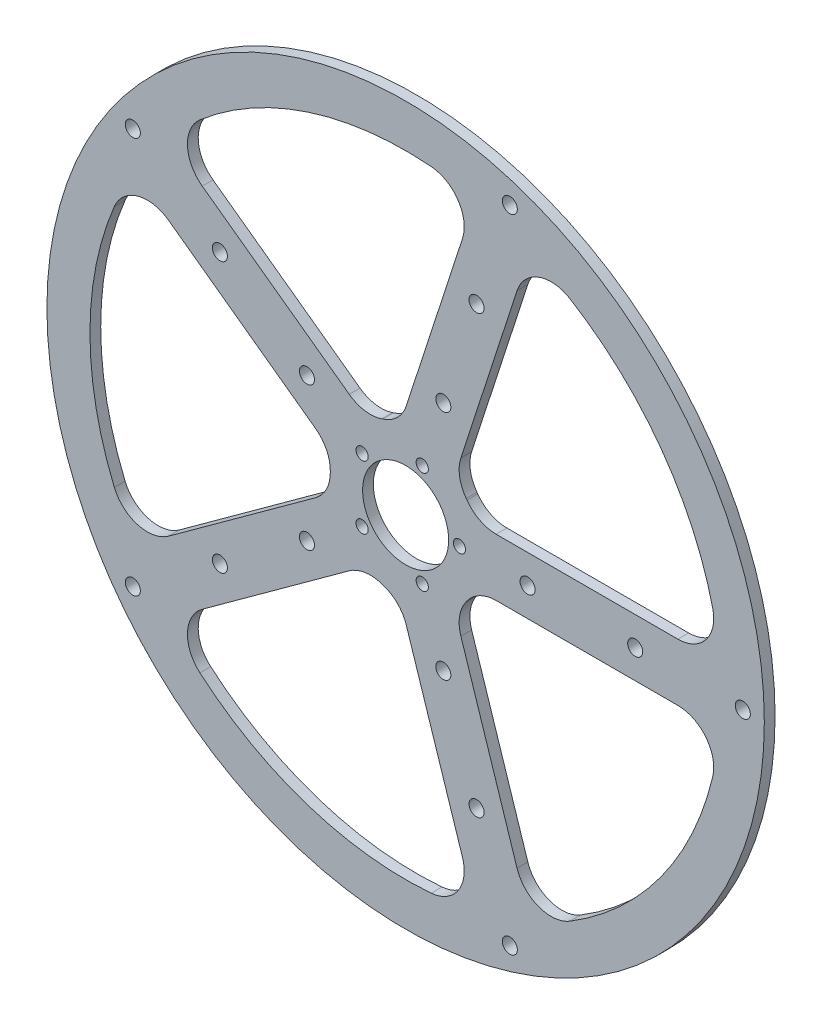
SolidWorks part; units mm, degrees
ref_plane "Plan de face" through (0, 0, 0) normal (0, 0, 1) x (1, 0, 0)
ref_plane "Plan de dessus" through (0, 0, 0) normal (0, 1, 0) x (1, 0, 0)
ref_plane "Plan de droite" through (0, 0, 0) normal (1, 0, 0) x (0, 0, -1)
sketch "Esquisse1" plane through (0, 0, 0) normal (0, 0, 1) x (1, 0, 0)
  line L0 (379.4733, 40) -> (126.1943, 40)
  line L1 (379.4733, -40) -> (126.1943, -40)
  line L2 (155.306, -348.5399) -> (77.0384, -107.6572)
  line L3 (79.2214, -373.2613) -> (0.9539, -132.3786)
  line L4 (-283.489, -255.4095) -> (-78.5819, -106.5358)
  line L5 (-330.5118, -190.6881) -> (-125.6047, -41.8145)
  line L6 (-330.5118, 190.6881) -> (-125.6047, 41.8145)
  line L7 (-283.489, 255.4095) -> (-78.5819, 106.5358)
  line L8 (79.2214, 373.2613) -> (0.9539, 132.3786)
  line L9 (155.306, 348.5399) -> (77.0384, 107.6572)
  circle A0 centre (0, 0) radius 500
  circle A1 centre (170, 0) radius 10.5
  circle A2 centre (320, 0) radius 10.5
  circle A3 centre (470, 0) radius 10.5
  circle A4 centre (75, 0) radius 8.5
  circle A5 centre (23.1763, -71.3292) radius 8.5
  circle A6 centre (52.5329, -161.6796) radius 10.5
  circle A7 centre (98.8854, -304.3381) radius 10.5
  circle A8 centre (145.238, -446.9966) radius 10.5
  circle A9 centre (-60.6763, -44.0839) radius 8.5
  circle A10 centre (-137.5329, -99.9235) radius 10.5
  circle A11 centre (-258.8854, -188.0913) radius 10.5
  circle A12 centre (-380.238, -276.2591) radius 10.5
  circle A13 centre (-60.6763, 44.0839) radius 8.5
  circle A14 centre (-137.5329, 99.9235) radius 10.5
  circle A15 centre (-258.8854, 188.0913) radius 10.5
  circle A16 centre (-380.238, 276.2591) radius 10.5
  circle A17 centre (23.1763, 71.3292) radius 8.5
  circle A18 centre (52.5329, 161.6796) radius 10.5
  circle A19 centre (98.8854, 304.3381) radius 10.5
  circle A20 centre (145.238, 446.9966) radius 10.5
  arc A21 (428.1237, 101.5385) -> (228.8663, 375.7928) centre (0, 0) ccw
  arc A22 (85.4865, 60.9677) -> (84.4005, 62.4624) centre (0, 0) ccw
  circle A23 centre (0, 0) radius 60
  arc A24 (379.4733, -40) -> (428.1237, -101.5385) centre (379.4733, -90) cw
  arc A25 (126.1943, -40) -> (85.4865, -60.9677) centre (126.1943, -90) ccw
  arc A26 (428.1237, 101.5385) -> (379.4733, 40) centre (379.4733, 90) cw
  arc A27 (126.1943, 40) -> (85.4865, 60.9677) centre (126.1943, 90) cw
  arc A28 (79.2214, -373.2613) -> (35.7287, -438.547) centre (31.6686, -388.7121) cw
  arc A29 (228.8663, -375.7928) -> (155.306, -348.5399) centre (202.8588, -333.089) cw
  arc A30 (77.0384, -107.6572) -> (84.4005, -62.4624) centre (124.5913, -92.2064) cw
  arc A31 (0.9539, -132.3786) -> (-31.567, -100.1425) centre (-46.5989, -147.8294) ccw
  arc A32 (-330.5118, -190.6881) -> (-406.0422, -169.4985) centre (-359.901, -150.2373) cw
  arc A33 (-286.6766, -333.7912) -> (-283.489, -255.4095) centre (-254.0997, -295.8604) cw
  arc A34 (-78.5819, -106.5358) -> (-33.3241, -99.5716) centre (-49.1927, -146.9867) cw
  arc A35 (-125.6047, -41.8145) -> (-104.9959, -0.9237) centre (-154.994, -1.3636) ccw
  arc A36 (-283.489, 255.4095) -> (-286.6766, 333.7912) centre (-254.0997, 295.8604) cw
  arc A37 (-406.0422, 169.4985) -> (-330.5118, 190.6881) centre (-359.901, 150.2373) cw
  arc A38 (-125.6047, 41.8145) -> (-104.9959, 0.9237) centre (-154.994, 1.3636) cw
  arc A39 (-78.5819, 106.5358) -> (-33.3241, 99.5716) centre (-49.1927, 146.9867) ccw
  arc A40 (155.306, 348.5399) -> (228.8663, 375.7928) centre (202.8588, 333.089) cw
  arc A41 (35.7287, 438.547) -> (79.2214, 373.2613) centre (31.6686, 388.7121) cw
  arc A42 (0.9539, 132.3786) -> (-31.567, 100.1425) centre (-46.5989, 147.8294) cw
  arc A43 (77.0384, 107.6572) -> (84.4005, 62.4624) centre (124.5913, 92.2064) ccw
  arc A44 (228.8663, -375.7928) -> (428.1237, -101.5385) centre (0, 0) ccw
  arc A45 (-286.6766, -333.7912) -> (35.7287, -438.547) centre (0, 0) ccw
  arc A46 (-406.0422, 169.4985) -> (-406.0422, -169.4985) centre (0, 0) ccw
  arc A47 (35.7287, 438.547) -> (-286.6766, 333.7912) centre (0, 0) ccw
  arc A48 (-31.567, 100.1425) -> (-33.3241, 99.5716) centre (0, 0) ccw
  arc A49 (-104.9959, 0.9237) -> (-104.9959, -0.9237) centre (0, 0) ccw
  arc A50 (-33.3241, -99.5716) -> (-31.567, -100.1425) centre (0, 0) ccw
  arc A51 (84.4005, -62.4624) -> (85.4865, -60.9677) centre (0, 0) ccw
  dimension "D1" = 1000
  dimension "D2" = 21
  dimension "D3" = 21
  dimension "D4" = 21
  dimension "D5" = 170
  dimension "D8" = 17
  dimension "D10" = 880
  dimension "D11" = 210
  dimension "D12" = 120
  dimension "D15" = 50
  dimension "D16" = 50
  dimension "D17" = 50
  dimension "D6" = 320
  dimension "D7" = 470
  dimension "D9" = 75
  dimension "D13" = 40
  dimension "D14" = 80
extrude "Extrusion1" add sketch "Esquisse1" along normal blind 15
